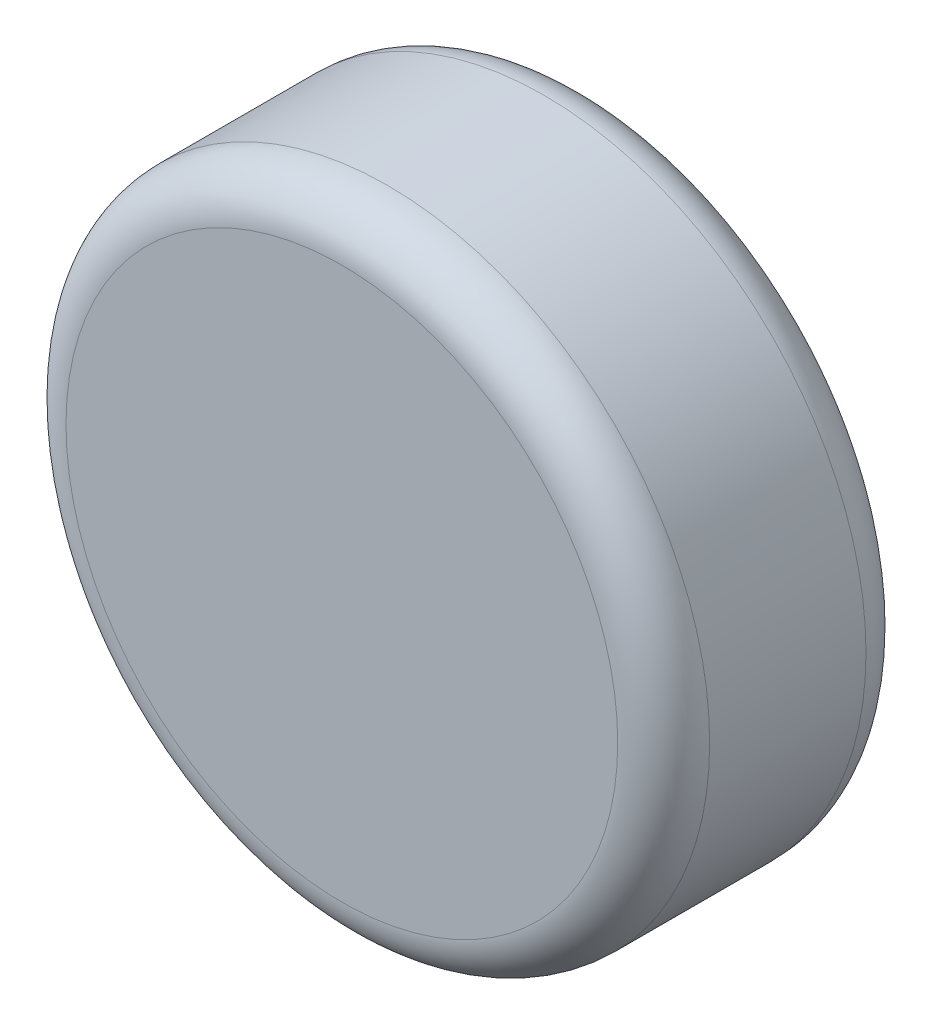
SolidWorks part; units mm, degrees
ref_plane "Plan de face" through (0, 0, 0) normal (0, 0, 1) x (1, 0, 0)
ref_plane "Plan de dessus" through (0, 0, 0) normal (0, 1, 0) x (1, 0, 0)
ref_plane "Plan de droite" through (0, 0, 0) normal (1, 0, 0) x (0, 0, -1)
sketch "Esquisse1" plane through (0, 0, 0) normal (0, 0, 1) x (1, 0, 0)
  circle A0 centre (0, 0) radius 35
  dimension "D1" = 70
extrude "Boss.-Extru.1" add sketch "Esquisse1" along normal blind 27
sketch "Esquisse2" plane through (0, 0, 0) normal (0, 0, -1) x (-1, 0, 0)
  line L0 (0, 2) -> (2, 0)
  line L1 (-2, 0) -> (0, -2)
  circle A0 centre (0, 0) radius 7
  arc A2 (-2, 0) -> (0, 2) centre (0, 0) cw
  arc A3 (2, 0) -> (0, -2) centre (0, 0) cw
  dimension "D1" = 14
extrude "Boss.-Extru.2" add sketch "Esquisse2" along normal blind 4
fillet "Congé1" radius 5 2 edges at (35, 0, 0) (35, 0, 27)
